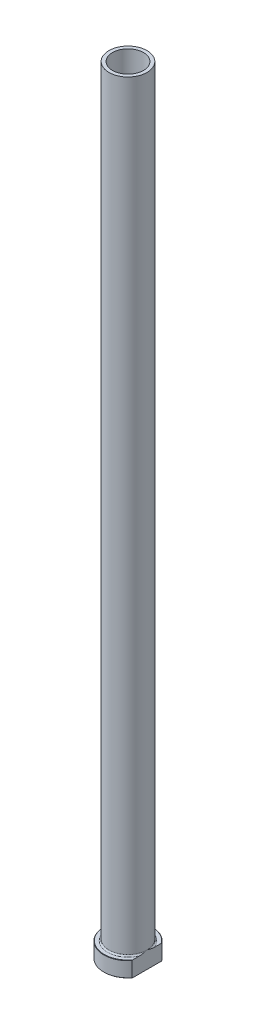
SolidWorks part; units mm, degrees
ref_plane "Front Plane" through (0, 0, 0) normal (0, 0, 1) x (1, 0, 0)
ref_plane "Top Plane" through (0, 0, 0) normal (0, 1, 0) x (1, 0, 0)
ref_plane "Right Plane" through (0, 0, 0) normal (1, 0, 0) x (0, 0, -1)
sketch "Sketch1" plane through (0, 0, 0) normal (0, 0, 1) x (1, 0, 0)
  line L0 (-9, 450) -> (-11, 450)
  line L1 (-11, 450) -> (-11, 9)
  line L2 (-11, 9) -> (-14, 9)
  line L3 (-14, 9) -> (-14, 0)
  line L4 (13.75, 0) -> (-13.75, 0) construction
  line L5 (-14, 0) -> (-9.25, 0)
  line L6 (-9, 395) -> (-9, 450)
  line L7 (0, 92.1877) -> (0, -15.5353) construction
  line L8 (0, -15.4) -> (0, 15.4) construction
  line L9 (-9, 395) -> (-9.25, 383)
  line L10 (-9.25, 383) -> (-9.25, 0)
  dimension "D1" = 0.25
  dimension "ID" = 18
  dimension "OD" = 22
  dimension "L" = 450
  dimension "H" = 28
  dimension "T" = 9
  dimension "N" = 55
  dimension "D2" = 12
  dimension "L-N" = 395
revolve "Revolve1" add sketch "Sketch1" angle 360 about L7
fillet "Fillet1" radius 0.8 1 edges at (0, 9, 11)
chamfer "Chamfer1" distance 0.2 angle 45 2 edges at (0, 9, 14) (0, 0, 14)
sketch "Sketch2" plane through (0, 0, 0) normal (0, -1, 0) x (1, 0, 0)
  line L0 (11, 8.6603) -> (11, -8.6603)
  circle A0 centre (0, 0) radius 14 construction
  arc A1 (11, 8.6603) -> (11, -8.6603) centre (0, 0) cw
  circle A2 centre (0, 0) radius 11 construction
extrude "Cut-Extrude1" cut sketch "Sketch2" against normal through all
chamfer "Chamfer2" distance 0.5 angle 45 1 edges at (0, 0, 9.25)
